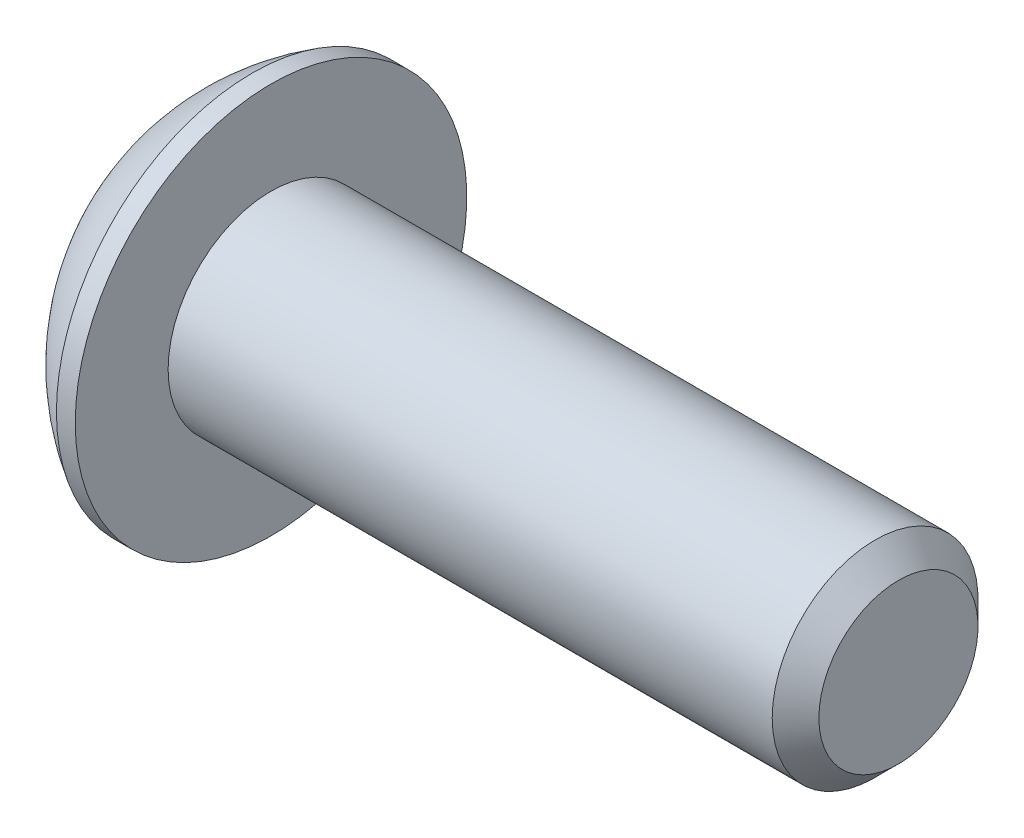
SolidWorks part; units mm, degrees
ref_plane "Plane1" through (0, 0, 0) normal (0, 0, 1) x (1, 0, 0)
ref_plane "Plane2" through (0, 0, 0) normal (0, 1, 0) x (1, 0, 0)
ref_plane "Plane3" through (0, 0, 0) normal (1, 0, 0) x (0, 0, -1)
sketch "BodySke" plane through (0, 0, 0) normal (0, 0, 1) x (1, 0, 0)
  line L0 (14.9098, 0) -> (14.9098, 1.6104)
  line L1 (14.4374, 2.0828) -> (2.2098, 2.0828)
  line L2 (2.2098, 2.0828) -> (2.2098, 3.9624)
  line L3 (2.2098, 3.9624) -> (1.8288, 3.9624)
  line L4 (0, 0) -> (101.6, 0) construction
  line L5 (2.2098, -3.9624) -> (1.8288, -3.9624) construction
  line L6 (55.6768, -2.0828) -> (2.2098, -2.0828) construction
  line L7 (14.9098, 0) -> (0, 0)
  line L8 (0, 1.9812) -> (0, -1.9812) construction
  line L9 (0, 0) -> (0, 1.9812)
  line L10 (14.9098, 1.6104) -> (14.4374, 2.0828)
  line L11 (14.9098, -1.6104) -> (14.4374, -2.0828) construction
  line L12 (3.0023, 9.525) -> (3.0023, -2.0828) construction
  line L13 (2.2098, 9.525) -> (2.2098, -2.0828) construction
  arc A1 (0, 1.9812) -> (1.8288, 3.9624) centre (4.1339, 0) cw
revolve "BaseBody" add sketch "BodySke" angle 360 about L4
sketch "Sketch2" plane through (0, 0, 0) normal (0, 0, 1) x (1, 0, 0)
  line L0 (0, 1.1938) -> (1.3208, 1.1938)
  line L1 (1.3208, 1.1938) -> (2.01, 0)
  line L3 (2.01, 0) -> (0, 0)
  line L4 (0, 0) -> (0, 1.1938)
  line L5 (0, -1.1938) -> (1.3208, -1.1938) construction
  line L6 (0, 0) -> (47.625, 0) construction
  dimension "D2" = 60
  dimension "PreBroach_depth" = 1.3208
  dimension "PreBroach_dia" = 2.3876
revolve "PreBroach" cut sketch "Sketch2" angle 360 about L6
sketch "Sketch3" plane through (0, 0, 0) normal (1, 0, 0) x (0, 0, -1)
  line L0 (-1.1938, -0.6892) -> (-1.1938, 0.6892)
  line L1 (-1.1938, 0.6892) -> (0, 1.3785)
  line L2 (0, 1.3785) -> (1.1938, 0.6892)
  line L3 (1.1938, 0.6892) -> (1.1938, -0.6892)
  line L4 (1.1938, -0.6892) -> (0, -1.3785)
  line L5 (0, -1.3785) -> (-1.1938, -0.6892)
extrude "Hex" cut sketch "Sketch3" along normal blind 1.3208
sketch "Sketch4" plane through (0, 9.525, 0) normal (1, 0, 0) x (0, 0, -1)
  line L0 (0, -9.525) -> (1.4605, -9.525)
  line L1 (0, -9.525) -> (6.1484, -5.9752) construction
  line L2 (0, -9.525) -> (0.7302, -8.2602)
  line L3 (1.2009, -9.1983) -> (1.3933, -9.0872)
  line L4 (0.8834, -8.6483) -> (1.0758, -8.5373)
  arc A0 (1.2009, -9.1983) -> (0.8834, -8.6483) centre (0, -9.525) ccw
  arc A1 (1.4605, -9.525) -> (1.3933, -9.0872) centre (0, -9.525) ccw
  arc A2 (0.7302, -8.2602) -> (1.0758, -8.5373) centre (0, -9.525) cw
extrude "Spline" [suppressed] cut sketch "Sketch4" along normal blind 1.3208
pattern_circular "CirPattern1" [suppressed] count 6 every 60 about axis through (0, 0, 0) along (1, 0, 0)
sketch "ThdSchSke" plane through (0, 0, 0) normal (0, 0, 1) x (1, 0, 0)
  line L0 (3.0023, -1.6104) -> (2.6715, -2.0828)
  line L1 (3.0023, -1.6104) -> (3.3331, -2.0828)
  line L2 (3.3331, -2.0828) -> (3.3331, -2.6035)
  line L3 (-3.175, 0) -> (5.1513, 0) construction
  line L5 (3.3331, -2.6035) -> (2.6715, -2.6035)
  line L6 (2.6715, -2.6035) -> (2.6715, -2.0828)
revolve "ThreadSchematic" [suppressed] cut sketch "ThdSchSke" angle 360 about L3
pattern_linear "ThdSchPat" [suppressed]
equation "\"D1@BodySke\" = \"Head_dia@BodySke\" * .5"
equation "\"Thread_minor@ThreadCosmetic\" = \"Minor_dia@BodySke\""
equation "\"D1@Sketch3\" = \"Hex_size@Sketch3\" / 2"
equation "\"D2@Sketch3\" = \"D1@Sketch3\""
equation "\"D3@Sketch3\" = \"Hex_size@Sketch3\""
equation "\"D3@Sketch4\" = \"Spline_p_dim@Sketch4\" / 2"
equation "\"D1@Sketch4\" = \"D2@Sketch4\" / 2"
equation "\"Thread_length@ThreadCosmetic\" = ((sgn( (\"Length@BodySke\" - \"Advance@BodySke\" ) - \"Thread_nom@BodySke\" )-1)*( (\"Length@BodySke\" - \"Advance@BodySke\" ) - \"Thread_nom@BodySke\" ))/-2+ \"Thread_nom@BodySke\""
equation "\"Thread_minor@ThdSchSke\" = \"Minor_dia@BodySke\""
equation "\"Diameter@ThdSchSke\" = \"Diameter@BodySke\""
equation "\"Overcut@ThdSchSke\" = \"Diameter@BodySke\" * 1.25"
equation "\"Start@ThdSchSke\" = \"Head_ht@BodySke\" + \"Length@BodySke\" - \"Thread_length@ThreadCosmetic\"  '---Non-countersunk---"
equation "\"Num_threads@ThdSchPat\" = int( \"Thread_length@ThreadCosmetic\" / \"Advance@BodySke\" + 0.999 )  + 1"
equation "\"Advance@ThdSchPat\" = \"Thread_length@ThreadCosmetic\" /  (\"Num_threads@ThdSchPat\" - 1) 'relax it"
equation "\"Num_threads@ThdSchPat\" = \"Num_threads@ThdSchPat\" - sgn( \"Num_threads@ThdSchPat\" - 1) '---chamfered tips only---"
